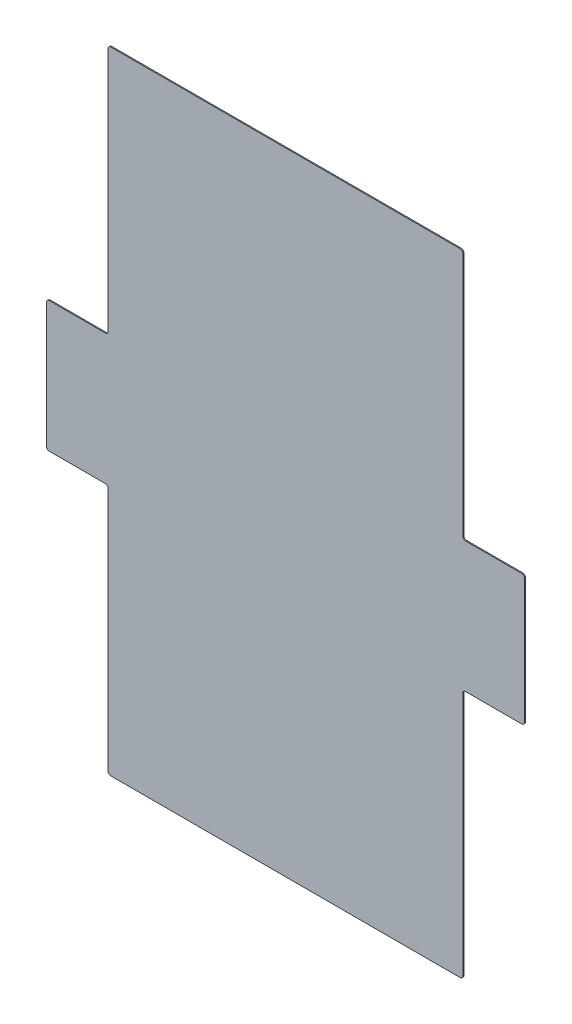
SolidWorks part; units mm, degrees
ref_plane "Plan1" through (0, 0, 0) normal (0, 0, 1) x (1, 0, 0)
ref_plane "Plan2" through (0, 0, 0) normal (0, 1, 0) x (1, 0, 0)
ref_plane "Plan3" through (0, 0, 0) normal (1, 0, 0) x (0, 0, -1)
sketch "Esquisse1" plane through (0, 0, 0) normal (0, 0, 1) x (1, 0, 0)
  line L0 (-453, 125) -> (-345, 125)
  line L1 (-458, 120) -> (-458, -120)
  line L2 (453, -125) -> (345, -125)
  line L3 (458, -120) -> (458, 120)
  line L4 (-335, 605) -> (335, 605)
  line L5 (-340, 600) -> (-340, 130)
  line L6 (335, -605) -> (-335, -605)
  line L7 (340, -600) -> (340, -130)
  line L8 (-340, -130) -> (-340, -600)
  line L9 (345, 125) -> (453, 125)
  line L10 (340, 130) -> (340, 600)
  line L11 (-345, -125) -> (-453, -125)
  line L12 (-90, 0) -> (90, 0) construction
  line L13 (0, 100) -> (0, -100) construction
  arc A0 (-458, 120) -> (-453, 125) centre (-453, 120) cw
  arc A1 (-453, -125) -> (-458, -120) centre (-453, -120) cw
  arc A2 (-340, -130) -> (-345, -125) centre (-345, -130) ccw
  arc A3 (-335, -605) -> (-340, -600) centre (-335, -600) cw
  arc A4 (340, -600) -> (335, -605) centre (335, -600) cw
  arc A5 (345, -125) -> (340, -130) centre (345, -130) ccw
  arc A6 (458, -120) -> (453, -125) centre (453, -120) cw
  arc A7 (453, 125) -> (458, 120) centre (453, 120) cw
  arc A8 (340, 130) -> (345, 125) centre (345, 130) ccw
  arc A9 (335, 605) -> (340, 600) centre (335, 600) cw
  arc A10 (-340, 600) -> (-335, 605) centre (-335, 600) cw
  arc A11 (-345, 125) -> (-340, 130) centre (-345, 130) ccw
  point P19 (-458, 125)
  point P24 (-340, -125)
  point P27 (-340, -605)
  point P34 (458, -125)
  point P37 (458, 125)
  point P40 (340, 125)
  point P43 (340, 605)
  point P46 (-340, 605)
  dimension "D5" = 5
  dimension "D1" = 250
  dimension "D2" = 916
  dimension "D3" = 680
  dimension "D4" = 1210
extrude "Base-Extrusion" add sketch "Esquisse1" along normal blind 2
sketch "Esquisse2" plane through (0, 0, 2) normal (0, 0, 1) x (1, 0, 0)
  line L1 (340, 130) -> (458, 130)
  line L2 (340, 130) -> (340, -130)
  line L3 (340, -130) -> (458, -130)
  line L4 (458, 130) -> (458, -130)
  line L5 (-458, 130) -> (-340, 130)
  line L6 (-458, 130) -> (-458, -130)
  line L7 (-458, -130) -> (-340, -130)
  line L8 (-340, 130) -> (-340, -130)
  line L9 (-458, 120) -> (-458, -120) construction
  line L11 (-340, -130) -> (-340, -600) construction
  line L13 (340, -600) -> (340, -130) construction
  line L15 (458, -120) -> (458, 120) construction
extrude "Enlèv. mat.-Extru.1" cut sketch "Esquisse2" against normal through all
sketch "Esquisse3" plane through (0, 0, 2) normal (0, 0, 1) x (1, 0, 0)
  line L0 (-335, 605) -> (335, 605) construction
  line L1 (340, -600) -> (340, 600) construction
  circle A0 centre (320, 585) radius 3.25
  dimension "D1" = 20
  dimension "D2" = 20
  dimension "D3" = 6.5
extrude "Enlèv. mat.-Extru.2" cut sketch "Esquisse3" against normal through all
pattern_linear "Répétition linéaire1" count 3 spacing 320 count 2 spacing 420
sketch "Esquisse4" plane through (0, 0, 2) normal (0, 0, 1) x (1, 0, 0)
  line L0 (335, -605) -> (-335, -605) construction
  line L1 (340, -600) -> (340, 600) construction
  circle A0 centre (320, -585) radius 3.25
  circle A1 centre (320, 585) radius 3.25 construction
  dimension "D1" = 20
  dimension "D2" = 20
extrude "Enlèv. mat.-Extru.3" cut sketch "Esquisse4" against normal through all
pattern_linear "Répétition linéaire2" count 3 spacing 320 count 2 spacing 420
